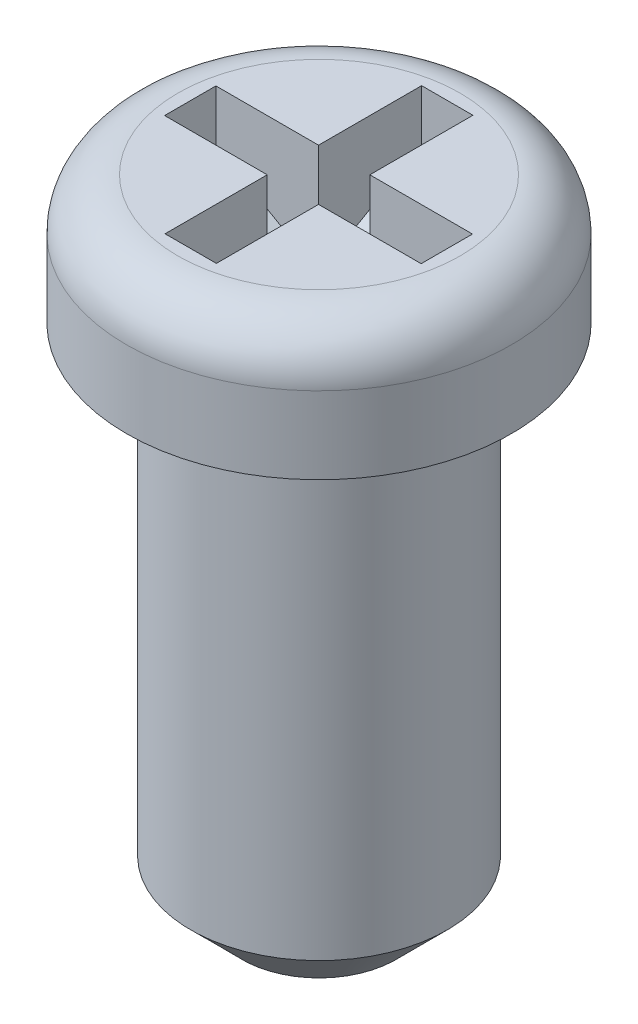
SolidWorks part; units mm, degrees
ref_plane "Plan de face" through (0, 0, 0) normal (0, 0, 1) x (1, 0, 0)
ref_plane "Plan de dessus" through (0, 0, 0) normal (0, 1, 0) x (1, 0, 0)
ref_plane "Plan de droite" through (0, 0, 0) normal (1, 0, 0) x (0, 0, -1)
sketch "Esquisse1" plane through (0, 0, 0) normal (0, 0, 1) x (1, 0, 0)
  line L0 (1.5, -0.4) -> (1.5, -1)
  line L1 (1.5, -1) -> (1, -1)
  line L2 (1, -1) -> (1, -4.6)
  line L3 (0.6, -5) -> (0, -5)
  line L4 (0, -5) -> (0, 0)
  line L5 (0, 0) -> (1.1, 0)
  line L6 (1, -4.6) -> (0.6, -5)
  arc A0 (1.5, -0.4) -> (1.1, 0) centre (1.1, -0.4) ccw
  point P11 (1.5, 0)
  dimension "D7" = 0.4
  dimension "D1" = 5
  dimension "D2" = 1
  dimension "D3" = 1
  dimension "D4" = 1.5
  dimension "D5" = 0.4
  dimension "D6" = 0.4
revolve "Révolution1" add sketch "Esquisse1" angle 360 about L4
sketch "Esquisse2" plane through (0, 0, 0) normal (0, 1, 0) x (1, 0, 0)
  line L0 (-0.2, -0.2036) -> (-0.2, -1)
  line L1 (-1, 0.1964) -> (-0.2, 0.1964)
  line L2 (-1, 0.1964) -> (-1, -0.2036)
  line L3 (-1, -0.2036) -> (-0.2, -0.2036)
  line L4 (1, 0.1964) -> (1, -0.2036)
  line L5 (-0.2, 1) -> (0.2, 1)
  line L6 (-0.2, 1) -> (-0.2, 0.1964)
  line L7 (-0.2, -1) -> (0.2, -1)
  line L8 (0.2, 1) -> (0.2, 0.1964)
  line L9 (0.2, 0.1964) -> (1, 0.1964)
  line L10 (0.2, -0.2036) -> (0.2, -1)
  line L11 (0.2, -0.2036) -> (1, -0.2036)
  dimension "D1" = 0.1964
  dimension "D2" = 0.4
  dimension "D3" = 0.2
  dimension "D4" = 0.4
  dimension "D5" = 1
  dimension "D6" = 1
  dimension "D7" = 1
  dimension "D8" = 1
extrude "Enlèv. mat.-Extru.1" cut sketch "Esquisse2" against normal blind 0.8
chamfer "Chanfrein1" distance 0.4 angle 60 4 edges at (-1, -0.8, 0.0036) (0, -0.8, 1) (0, -0.8, -1) (1, -0.8, 0.0036)
